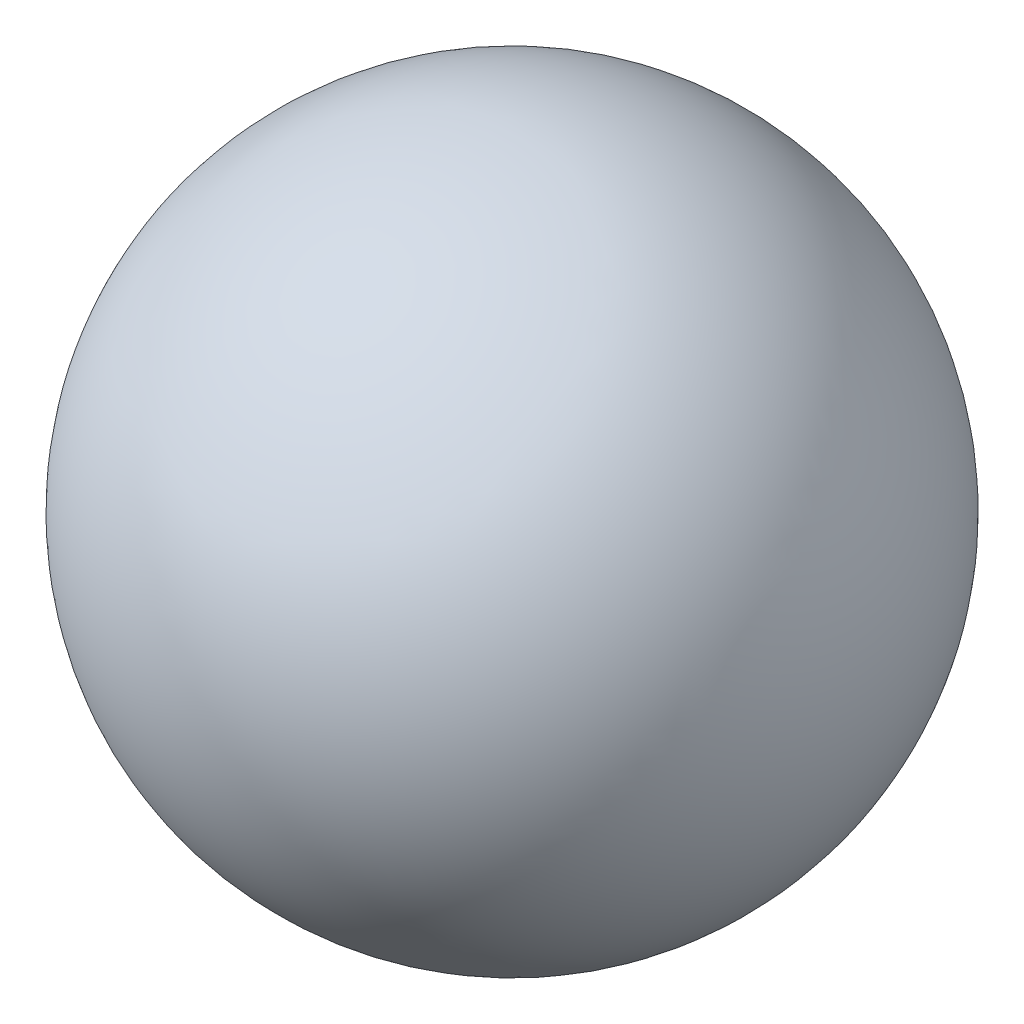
SolidWorks part; units mm, degrees
ref_plane "Front Plane" through (0, 0, 0) normal (0, 0, 1) x (1, 0, 0)
ref_plane "Top Plane" through (0, 0, 0) normal (0, 1, 0) x (1, 0, 0)
ref_plane "Right Plane" through (0, 0, 0) normal (1, 0, 0) x (0, 0, -1)
sketch "Sketch1" plane through (0, 0, 0) normal (0, 0, 1) x (1, 0, 0)
  line L0 (-6.35, 0) -> (6.35, 0)
  point P4 (0, 0)
  dimension "Diameter" = 12.7
sketch "Sketch2" plane through (0, 0, 0) normal (0, 0, 1) x (1, 0, 0)
  line L1 (-6.35, 0) -> (6.35, 0)
  arc A1 (6.35, 0) -> (-6.35, 0) centre (0, 0) ccw
revolve "Revolve1" add sketch "Sketch2" angle 360 about L1
